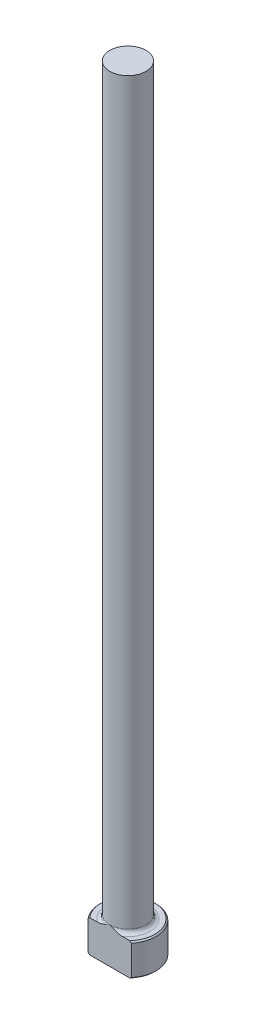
SolidWorks part; units mm, degrees
ref_plane "Front Plane" through (0, 0, 0) normal (0, 0, 1) x (1, 0, 0)
ref_plane "Top Plane" through (0, 0, 0) normal (0, 1, 0) x (1, 0, 0)
ref_plane "Right Plane" through (0, 0, 0) normal (1, 0, 0) x (0, 0, -1)
sketch "Sketch1" plane through (0, 0, 0) normal (0, 0, 1) x (1, 0, 0)
  line L0 (0, 259.9588) -> (0, -15.1925) construction
  line L1 (0, 0) -> (-5.5499, 0)
  line L2 (-5.5499, 0) -> (-5.5499, 6.35)
  line L3 (-5.5499, 6.35) -> (-3.5712, 6.35)
  line L4 (-3.5712, 6.35) -> (-3.5712, 152.4)
  line L5 (-3.5712, 152.4) -> (0, 152.4)
  line L6 (0, 152.4) -> (0, 0)
  dimension "L" = 152.4
  dimension "H" = 11.0998
  dimension "T" = 6.35
  dimension "D" = 7.1425
revolve "Revolve1" add sketch "Sketch1" angle 360 about L0
chamfer "Chamfer1" distance 0.254 angle 45 2 edges at (0, 6.35, 5.5499) (0, 0, 5.5499)
fillet "Fillet1" radius 0.762 1 edges at (0, 6.35, 3.5712)
sketch "Sketch2" plane through (0, 0, 0) normal (0, -1, 0) x (1, 0, 0)
  line L0 (-4.2483, 3.5712) -> (4.2483, 3.5712)
  arc A0 (4.2483, 3.5712) -> (-4.2483, 3.5712) centre (0, 0) ccw
  circle A1 centre (0, 0) radius 5.5499 construction
  circle A3 centre (0, 0) radius 3.5712 construction
extrude "KEY" cut sketch "Sketch2" against normal through all
sketch "Pocket Sketch" plane through (0, 0, 0) normal (0, 0, 1) x (1, 0, 0)
  line L0 (-5.9468, 0) -> (-5.9468, 6.3754)
  line L1 (-5.9468, 6.3754) -> (-4.7301, 6.3754)
  line L2 (-3.9681, 7.1374) -> (-3.9681, 22.225)
  line L3 (-3.9681, 22.225) -> (0, 22.225)
  line L4 (0, 22.225) -> (0, 0)
  line L5 (0, 0) -> (-5.9468, 0)
  line L6 (0, 12.6104) -> (0, -2.4989) construction
  line L7 (-5.5499, 6.096) -> (-5.5499, 0.254) construction
  line L8 (5.2959, 6.35) -> (-5.2959, 6.35) construction
  line L9 (-3.5712, 152.4) -> (-3.5712, 7.112) construction
  line L10 (-4.7301, 6.3754) -> (-3.9681, 7.1374)
  point P3 (-3.9681, 6.3754)
  dimension "D1" = 11.8935
  dimension "D2" = 0.3969
  dimension "D3" = 0.0254
  dimension "D4" = 0.3969
  dimension "D5" = 7.9362
  dimension "D6" = 22.225
